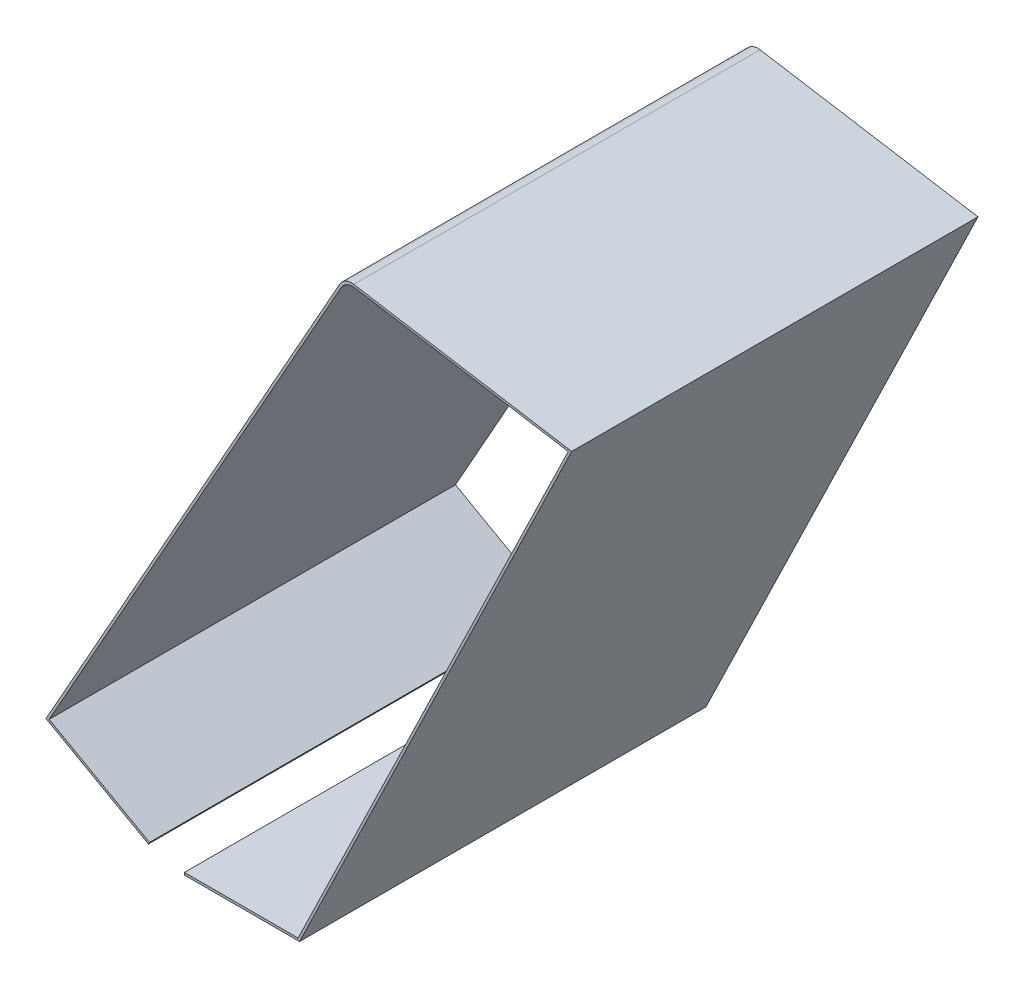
SolidWorks part; units mm, degrees
ref_plane "Front" through (0, 0, 0) normal (0, 0, 1) x (1, 0, 0)
ref_plane "Top" through (0, 0, 0) normal (0, 1, 0) x (1, 0, 0)
ref_plane "Right" through (0, 0, 0) normal (1, 0, 0) x (0, 0, -1)
sketch "Sketch1" plane through (0, 0, 0) normal (0, 0, 1) x (1, 0, 0)
  line L0 (-0.3428, -0.6105) -> (-22.0333, -39.2369)
  line L1 (-22.0333, -39.2369) -> (-14.4737, -43.482)
  line L3 (-3.314, -44.1332) -> (16.7758, -2.752)
  line L4 (16.7758, -2.752) -> (0.691, -0.1134)
  line L5 (-21.8018, -39.1719) -> (-14.3904, -43.3337)
  line L7 (-3.4204, -43.9632) -> (16.5233, -2.8829)
  line L8 (16.5233, -2.8829) -> (0.7809, -0.3004)
  line L9 (-0.2529, -0.7976) -> (-21.8018, -39.1719)
  line L10 (-14.3904, -43.3337) -> (-14.4737, -43.482)
  line L12 (-3.314, -44.1332) -> (-11.814, -44.1332)
  line L13 (-13.314, -44.1332) -> (-11.814, -44.1332) construction
  line L14 (-14.4737, -43.482) -> (-13.314, -44.1332) construction
  line L16 (-11.814, -43.9632) -> (-3.4204, -43.9632)
  line L18 (-11.814, -44.1332) -> (-11.814, -43.9632)
  arc A0 (0.7809, -0.3004) -> (-0.2529, -0.7976) centre (0.619, -1.2872) ccw
  arc A1 (-0.3428, -0.6105) -> (0.691, -0.1134) centre (0.5291, -1.1002) cw
  point P18 (0, 0)
  dimension "D14" = 1
  dimension "D15" = 1
  dimension "D1" = 17
  dimension "D2" = 45
  dimension "D3" = 10
  dimension "D4" = 110
  dimension "D5" = 46
  dimension "D6" = 10
  dimension "D7" = 0.17
  dimension "D8" = 0.17
  dimension "D9" = 0.17
  dimension "D10" = 0.17
  dimension "D11" = 8.5
  dimension "D12" = 0.17
  dimension "D13" = 8.5
extrude "Boss-Extrude1" add sketch "Sketch1" along normal blind 30
